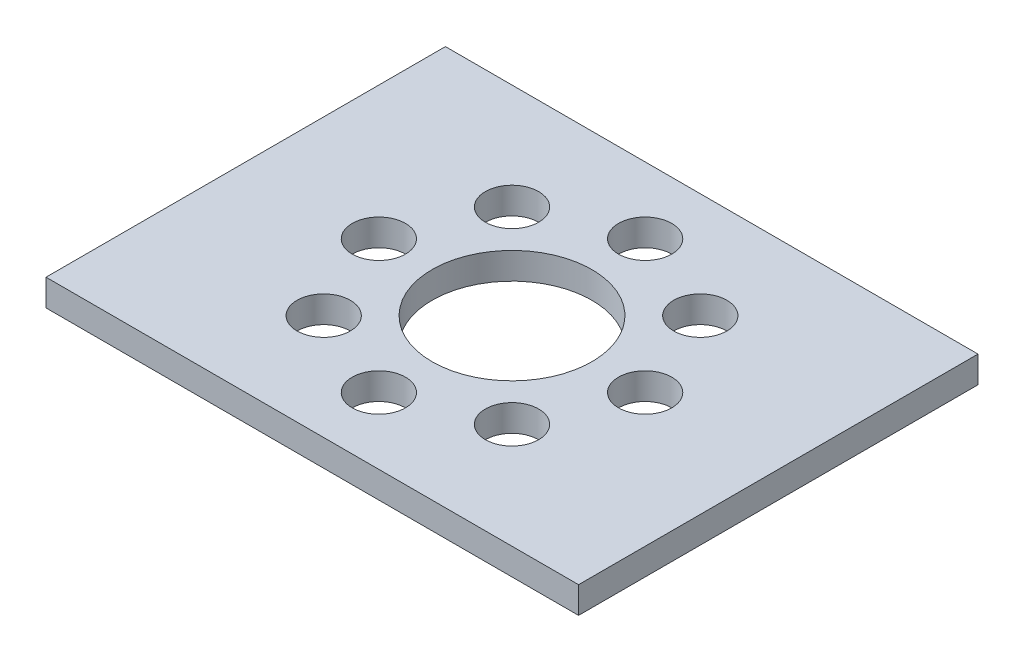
SolidWorks part; units mm, degrees
ref_plane "Front Plane" through (0, 0, 0) normal (0, 0, 1) x (1, 0, 0)
ref_plane "Top Plane" through (0, 0, 0) normal (0, 1, 0) x (1, 0, 0)
ref_plane "Right Plane" through (0, 0, 0) normal (1, 0, 0) x (0, 0, -1)
sketch "Sketch1" plane through (0, 0, 0) normal (0, 1, 0) x (1, 0, 0)
  line L1 (-100, -75) -> (100, -75)
  line L2 (-100, -75) -> (-100, 75)
  line L3 (-100, 75) -> (100, 75)
  line L4 (100, -75) -> (100, 75)
  line L5 (-100, -75) -> (100, 75) construction
  line L6 (-100, 75) -> (100, -75) construction
  circle A0 centre (0, 0) radius 30
  point P0 (0, 0)
  dimension "D3" = 60
  dimension "D1" = 200
  dimension "D2" = 150
extrude "Boss-Extrude1" add sketch "Sketch1" along normal blind 10
sketch "Sketch2" plane through (0, 10, 0) normal (0, 1, 0) x (1, 0, 0)
  circle A0 centre (0, 50) radius 10
  circle A1 centre (35.3553, 35.3553) radius 10
  circle A2 centre (50, 0) radius 10
  circle A3 centre (35.3553, -35.3553) radius 10
  circle A4 centre (0, -50) radius 10
  circle A5 centre (-35.3553, -35.3553) radius 10
  circle A6 centre (-50, 0) radius 10
  circle A7 centre (-35.3553, 35.3553) radius 10
  point P18 (0, 0)
  dimension "D2" = 20
  dimension "D3" = 50
  dimension "D1" = 8
extrude "Cut-Extrude1" cut sketch "Sketch2" against normal blind 10
